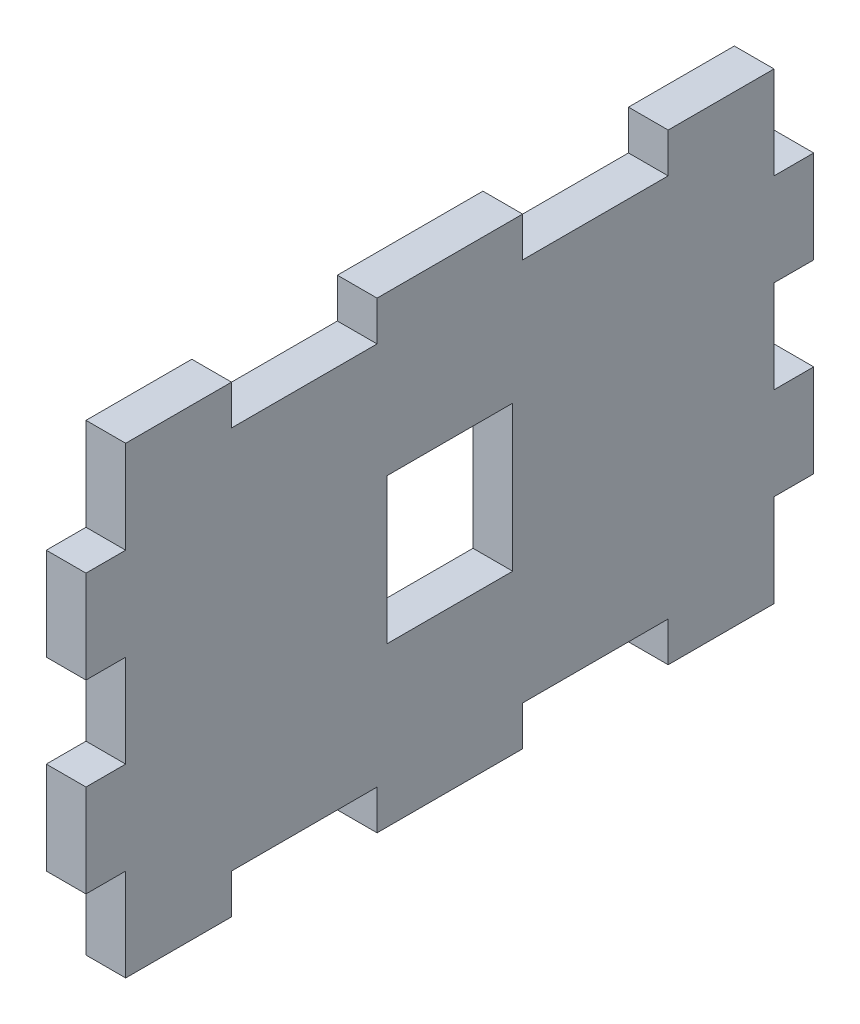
SolidWorks part; units mm, degrees
ref_plane "Front Plane" through (0, 0, 0) normal (0, 0, 1) x (1, 0, 0)
ref_plane "Top Plane" through (0, 0, 0) normal (0, 1, 0) x (1, 0, 0)
ref_plane "Right Plane" through (0, 0, 0) normal (1, 0, 0) x (0, 0, -1)
sketch "Sketch1" plane through (0, 0, 0) normal (1, 0, 0) x (0, 0, -1)
  line L1 (-27.5, 17.5) -> (27.5, 17.5)
  line L2 (-27.5, 17.5) -> (-27.5, -17.5)
  line L3 (-27.5, -17.5) -> (27.5, -17.5)
  line L4 (27.5, 17.5) -> (27.5, -17.5)
  line L5 (-27.5, 17.5) -> (27.5, -17.5) construction
  line L6 (-27.5, -17.5) -> (27.5, 17.5) construction
  point P0 (0, 0)
  dimension "D1" = 55
  dimension "D2" = 35
extrude "Boss-Extrude1" add sketch "Sketch1" along normal blind 3
sketch "Sketch3" plane through (3, 0, 0) normal (1, 0, 0) x (0, 0, -1)
  line L0 (-27.5, 17.5) -> (-16.5, 17.5)
  line L1 (27.5, 17.5) -> (-27.5, 17.5) construction
  line L2 (-16.5, 17.5) -> (-16.5, 14.5)
  line L3 (-16.5, 14.5) -> (-5.5, 14.5)
  line L4 (-5.5, 14.5) -> (-5.5, 17.5)
  line L5 (-5.5, 17.5) -> (5.5, 17.5)
  line L6 (5.5, 17.5) -> (5.5, 14.5)
  line L7 (5.5, 14.5) -> (16.5, 14.5)
  line L8 (16.5, 14.5) -> (16.5, 17.5)
  line L9 (16.5, 17.5) -> (27.5, 17.5)
  line L10 (-27.5, 0) -> (27.5, 0) construction
  line L11 (-27.5, 17.5) -> (-27.5, -17.5) construction
  line L12 (27.5, -17.5) -> (27.5, 17.5) construction
  line L13 (16.5, -17.5) -> (27.5, -17.5)
  line L14 (16.5, -14.5) -> (16.5, -17.5)
  line L15 (5.5, -14.5) -> (16.5, -14.5)
  line L16 (5.5, -17.5) -> (5.5, -14.5)
  line L17 (-5.5, -17.5) -> (5.5, -17.5)
  line L18 (-5.5, -14.5) -> (-5.5, -17.5)
  line L19 (-16.5, -14.5) -> (-5.5, -14.5)
  line L20 (-16.5, -17.5) -> (-16.5, -14.5)
  line L21 (-27.5, -17.5) -> (-16.5, -17.5)
  line L22 (-16.5, 17.5) -> (16.5, 17.5)
  line L23 (-16.5, -17.5) -> (16.5, -17.5)
extrude "Cut-Extrude1" cut sketch "Sketch3" against normal blind 3 contours L3 L4 L2 M12 | L7 L8 L6 M12 | L16 L14 L15 M14 | L20 L18 L19 M14
sketch "Sketch4" plane through (3, 0, 0) normal (1, 0, 0) x (0, 0, -1)
  line L0 (-27.5, 17.5) -> (-24.5, 17.5)
  line L1 (-16.5, 17.5) -> (-27.5, 17.5) construction
  line L2 (-24.5, 17.5) -> (-24.5, 10.5)
  line L3 (-24.5, 10.5) -> (-27.5, 10.5)
  line L4 (-27.5, 17.5) -> (-27.5, -17.5) construction
  line L5 (-27.5, 10.5) -> (-27.5, 3.5)
  line L6 (-27.5, 3.5) -> (-24.5, 3.5)
  line L7 (-24.5, 3.5) -> (-24.5, -3.5)
  line L8 (-24.5, -3.5) -> (-27.5, -3.5)
  line L9 (-27.5, -3.5) -> (-27.5, -10.5)
  line L10 (-27.5, -10.5) -> (-24.5, -10.5)
  line L11 (-24.5, -10.5) -> (-24.5, -17.5)
  line L12 (-24.5, -17.5) -> (-27.5, -17.5)
  line L15 (0, 17.5) -> (0, -17.5) construction
  line L16 (5.5, 17.5) -> (-5.5, 17.5) construction
  line L17 (-5.5, -17.5) -> (5.5, -17.5) construction
  line L18 (24.5, -17.5) -> (27.5, -17.5)
  line L19 (24.5, -10.5) -> (24.5, -17.5)
  line L20 (27.5, -10.5) -> (24.5, -10.5)
  line L21 (24.5, -3.5) -> (27.5, -3.5)
  line L22 (24.5, 3.5) -> (24.5, -3.5)
  line L23 (27.5, 3.5) -> (24.5, 3.5)
  line L24 (27.5, 10.5) -> (27.5, 3.5)
  line L25 (24.5, 10.5) -> (27.5, 10.5)
  line L26 (24.5, 17.5) -> (24.5, 10.5)
  line L27 (27.5, 17.5) -> (24.5, 17.5)
  line L28 (-27.5, 17.5) -> (-27.5, -17.5)
  line L29 (27.5, -17.5) -> (27.5, 17.5)
extrude "Cut-Extrude2" cut sketch "Sketch4" against normal blind 3 contours L3 L2 M6 M7 | L8 L7 L6 M7 | L11 L10 M7 M8 | L26 L25 M18 M17 | L23 L22 L21 M17 | L20 L19 M17 M16
sketch "Sketch5" plane through (3, 0, 0) normal (1, 0, 0) x (0, 0, -1)
  line L0 (-16.5, 14.5) -> (-24.5, 14.5) construction
  line L1 (-24.5, 17.5) -> (-24.5, 10.5) construction
  line L2 (-24.5, 14.5) -> (24.5, 14.5) construction
  line L3 (24.5, 17.5) -> (24.5, 10.5) construction
  line L5 (24.5, -10.5) -> (24.5, -17.5) construction
  line L6 (16.5, -14.5) -> (24.5, -14.5) construction
  line L7 (24.5, -14.5) -> (24.5, 14.5) construction
  line L8 (-4.75, 5.5) -> (4.75, 5.5)
  line L9 (-4.75, 5.5) -> (-4.75, -5.5)
  line L10 (-4.75, -5.5) -> (4.75, -5.5)
  line L11 (4.75, 5.5) -> (4.75, -5.5)
  line L12 (-4.75, 5.5) -> (4.75, -5.5) construction
  line L13 (-4.75, -5.5) -> (4.75, 5.5) construction
  point P9 (0, 0)
  dimension "D1" = 11
  dimension "D2" = 9.5
extrude "Cut-Extrude3" cut sketch "Sketch5" against normal blind 10
equation "\"Thickness of material\"= 3mm"
equation "\"Length of box\"= 155mm"
equation "\"width of box\"= 55mm"
equation "\"D1@Boss-Extrude1\"=\"Thickness of material\""
equation "\"D1@Sketch3\"=\"width of box\"/5"
equation "\"D2@Sketch3\"=\"width of box\"/5"
equation "\"D3@Sketch3\"=\"width of box\"/5"
equation "\"D4@Sketch3\"=\"width of box\"/5"
equation "\"height of box\"= 35mm"
equation "\"D5@Sketch3\"=\"Thickness of material\""
equation "\"D6@Sketch3\"=\"Thickness of material\""
equation "\"D1@Sketch4\"=\"height of box\"/5"
equation "\"D2@Sketch4\"=\"height of box\"/5"
equation "\"D3@Sketch4\"=\"height of box\"/5"
equation "\"D4@Sketch4\"=\"height of box\"/5"
equation "\"D5@Sketch4\"=\"height of box\"/5"
equation "\"D6@Sketch4\"=\"Thickness of material\""
equation "\"D7@Sketch4\"=\"Thickness of material\""
equation "\"D8@Sketch4\"=\"Thickness of material\""
